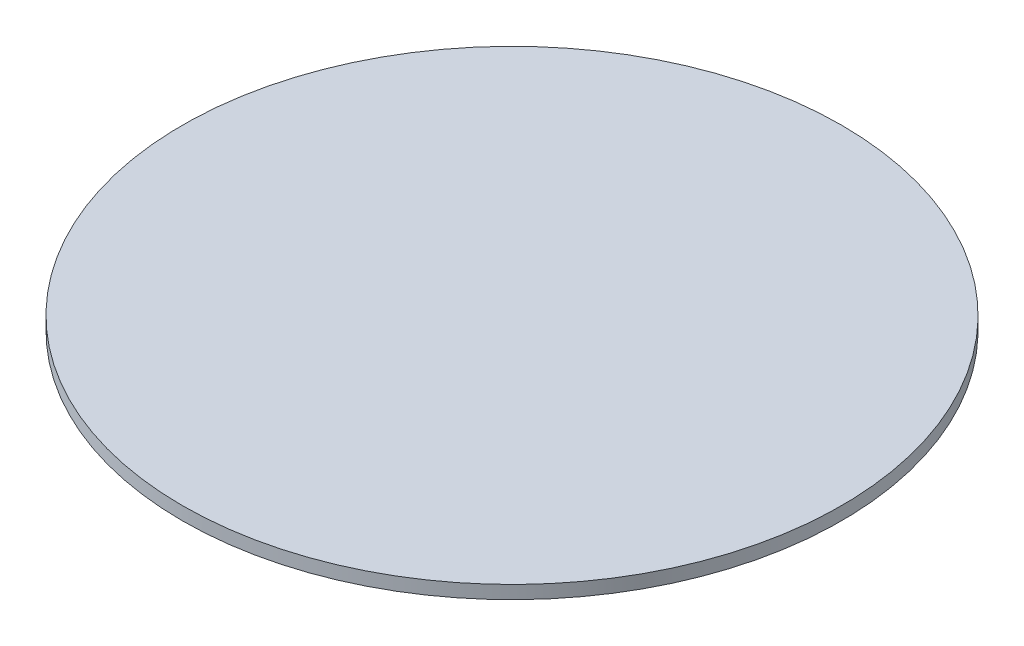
SolidWorks part; units mm, degrees
ref_plane "Front Plane" through (0, 0, 0) normal (0, 0, 1) x (1, 0, 0)
ref_plane "Top Plane" through (0, 0, 0) normal (0, 1, 0) x (1, 0, 0)
ref_plane "Right Plane" through (0, 0, 0) normal (1, 0, 0) x (0, 0, -1)
sketch "Sketch1" plane through (0, 0, 0) normal (0, 1, 0) x (1, 0, 0)
  circle A0 centre (0, 0) radius 25
  dimension "D1" = 50
extrude "Extrude1" add sketch "Sketch1" along normal blind 1
